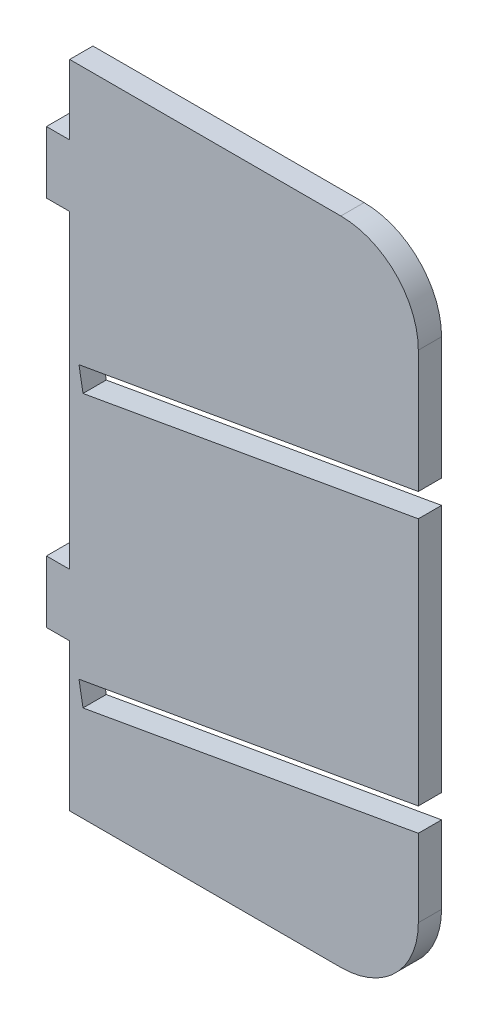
SolidWorks part; units mm, degrees
ref_plane "Front Plane" through (0, 0, 0) normal (0, 0, 1) x (1, 0, 0)
ref_plane "Top Plane" through (0, 0, 0) normal (0, 1, 0) x (1, 0, 0)
ref_plane "Right Plane" through (0, 0, 0) normal (1, 0, 0) x (0, 0, -1)
sketch "Croquis1" plane through (0, 0, 0) normal (0, 0, 1) x (1, 0, 0)
  line L0 (-125, 175) -> (-140, 175)
  line L1 (-125, 220) -> (100, 220)
  line L2 (-125, 220) -> (-125, 175)
  line L3 (-125, -200) -> (100, -200)
  line L4 (100, 220) -> (100, -200)
  line L5 (-140, 175) -> (-140, 135)
  line L6 (-140, 135) -> (-125, 135)
  line L7 (-125, -65) -> (-140, -65)
  line L8 (-140, -65) -> (-140, -105)
  line L9 (-140, -105) -> (-125, -105)
  line L10 (-125, 135) -> (-125, -65)
  line L11 (-125, -105) -> (-125, -200)
  dimension "D1" = 225
  dimension "D2" = 125
  dimension "D3" = 420
  dimension "D4" = 200
  dimension "D5" = 40
  dimension "D6" = 40
  dimension "D7" = 15
  dimension "D8" = 15
  dimension "D9" = 45
  dimension "D10" = 285
extrude "Saliente-Extruir1" add sketch "Croquis1" along normal blind 15
fillet "Redondeo1" radius 50 1 edges at (100, -200, 7.5)
fillet "Redondeo2" radius 50 1 edges at (100, 220, 7.5)
sketch "Croquis4" plane through (0, 0, 15) normal (0, 0, 1) x (1, 0, 0)
  line L0 (100, 91) -> (-119, 52.3844)
  line L1 (100, 91) -> (-119, 52.3844) construction
  line L2 (100, -150) -> (100, 170) construction
  line L3 (-119, 52.3844) -> (-116.3953, 37.6123)
  line L4 (-116.3953, 37.6123) -> (100, 75.7686)
  line L5 (-116.3953, 37.6123) -> (100, 75.7686) construction
  line L6 (100, 75.7686) -> (100, 91)
  line L7 (-119, -123.3842) -> (-116.3953, -138.1563)
  line L8 (-116.3953, -138.1563) -> (100, -100)
  line L9 (-116.3953, -138.1563) -> (100, -100) construction
  line L10 (100, -100) -> (100, -84.7686)
  line L11 (100, -84.7686) -> (-119, -123.3842) construction
  line L12 (100, -84.7686) -> (-119, -123.3842)
  dimension "D1" = 15
extrude "Cortar-Extruir2" cut sketch "Croquis4" against normal up to next
